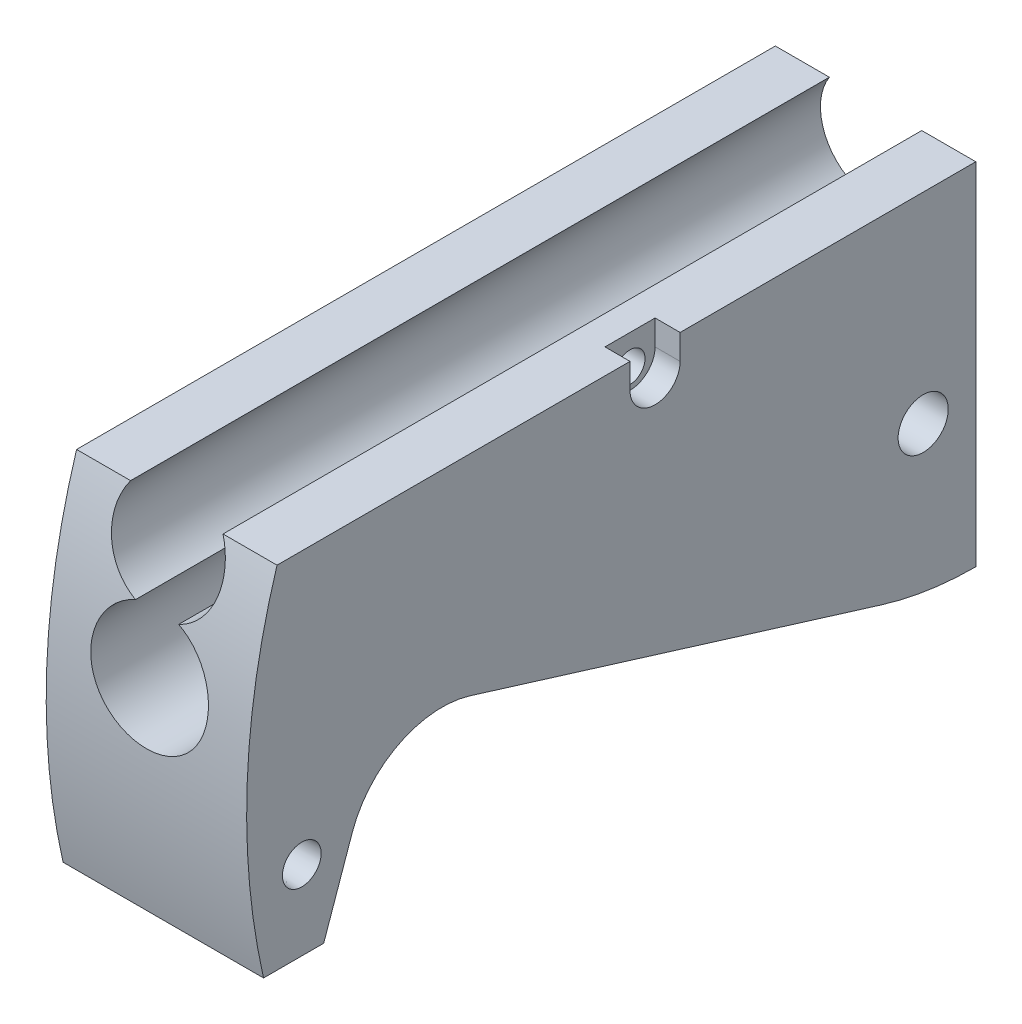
SolidWorks part; units mm, degrees
ref_plane "Front Plane" through (0, 0, 0) normal (0, 0, 1) x (1, 0, 0)
ref_plane "Top Plane" through (0, 0, 0) normal (0, 1, 0) x (1, 0, 0)
ref_plane "Right Plane" through (0, 0, 0) normal (1, 0, 0) x (0, 0, -1)
sketch "Sketch1" plane through (0, 0, 0) normal (0, 0, 1) x (1, 0, 0)
  line L1 (-20, 35) -> (20, 35)
  line L2 (-20, 35) -> (-20, -35)
  line L3 (-20, -35) -> (20, -35)
  line L4 (20, 35) -> (20, -35)
  line L5 (-20, 35) -> (20, -35) construction
  line L6 (-20, -35) -> (20, 35) construction
  point P0 (0, 0)
  dimension "D1" = 40
  dimension "D2" = 70
extrude "Boss-Extrude1" add sketch "Sketch1" along normal blind 147
sketch "Sketch2" plane through (20, 0, 0) normal (1, 0, 0) x (0, 0, -1)
  line L0 (-147, 29) -> (0, 29) construction
  line L1 (-147, -35) -> (0, -35) construction
  line L2 (-130.1245, -35) -> (-124.4353, -18.7289)
  line L3 (-100.898, -6.8446) -> (-18.8698, -32.155)
  line L4 (-147, -35) -> (-147, 35) construction
  line L5 (0, -35) -> (0, 35) construction
  line L6 (-147, 35) -> (0, 35) construction
  line L7 (0, -35) -> (0, 35) construction
  line L9 (-139.438, 35) -> (0, 35)
  line L10 (0, 35) -> (0, -35)
  line L11 (-130.1245, -35) -> (-142.1245, -35)
  arc A0 (-124.4353, -18.7289) -> (-100.898, -6.8446) centre (-106.5, -25) cw
  arc A1 (-18.8698, -32.155) -> (0, -35) centre (0, 29) ccw
  circle A2 centre (-10.5, -5) radius 5
  arc A3 (-139.438, 35) -> (-142.1245, -35) centre (-10.5, -5) ccw
  dimension "D2" = 19
  dimension "D4" = 128
  dimension "D8" = 10
  dimension "D10" = 270
  dimension "D3" = 6
  dimension "D5" = 60
  dimension "D6" = 40.5
  dimension "D7" = 10.5
  dimension "D9" = 40
  dimension "D11" = 12
extrude "Cut-Extrude1" cut sketch "Sketch2" against normal blind 147 flip side to cut
ref_plane "Plane1" through (0, 0, 147) normal (0, 0, 1) x (1, 0, 0)
sketch "Sketch3" plane through (0, 0, 147) normal (0, 0, 1) x (1, 0, 0)
  line L0 (-20, 35) -> (20, 35) construction
  line L1 (-9.2195, 35) -> (9.2195, 35)
  arc A0 (-9.2195, 35) -> (9.2195, 35) centre (0, 29) ccw
  circle A1 centre (0, 8) radius 6
  dimension "D1" = 22
  dimension "D2" = 12
  dimension "D3" = 6
  dimension "D4" = 27
extrude "Cut-Extrude2" cut sketch "Sketch3" against normal through all
ref_plane "Plane2" through (2, 0, 0) normal (1, 0, 0) x (0, 0, -1)
sketch "Sketch7" plane through (2, 0, 0) normal (1, 0, 0) x (0, 0, -1)
  line L1 (0, -35) -> (0, 35) construction
  line L3 (0, -35) -> (0, 25)
  line L5 (0, 25) -> (-63.8749, 25)
  arc A0 (-63.8749, 25) -> (0, -35) centre (0, 29) ccw
  dimension "D1" = 60
extrude "Cut-Extrude6" cut sketch "Sketch7" against normal blind 4
sketch "Sketch8" plane through (0, 0, 147) normal (0, 0, 1) x (1, 0, 0)
  circle A0 centre (0, 8) radius 11.69
  dimension "D1" = 23.38
extrude "Cut-Extrude7" cut sketch "Sketch8" against normal blind 33
sketch "Sketch10" plane through (0, 0, 0) normal (0, 0, -1) x (-1, 0, 0)
  circle A0 centre (0, 8) radius 6.5
  dimension "D1" = 13
extrude "Cut-Extrude8" cut sketch "Sketch10" against normal blind 64
sketch "Sketch11" plane through (20, 0, 0) normal (1, 0, 0) x (0, 0, -1)
  line L1 (-142.1245, -35) -> (-130.1245, -35) construction
  circle A0 centre (-134.5, -19.2) radius 3.865
  dimension "D1" = 7.73
  dimension "D2" = 28
  dimension "D3" = 15.8
extrude "Cut-Extrude10" cut sketch "Sketch11" against normal blind 15.2 draft 2.27
hole_wizard "Ø6.5 (6.5) Diameter Hole1" positions "Sketch13" profile "Sketch12" hole size "Ø6.5" standard "ANSI Metric"
sketch "Sketch13" plane through (4.8, 0, 0) normal (1, 0, 0) x (0, 0, -1)
  point P0 (-134.5, -19.2)
sketch "Sketch12" plane through (4.8, -19.2, 134.5) normal (0, 1, 0) x (0, 0, -1)
  line L0 (0, 0) -> (0, 13.3528)
  line L1 (0, 13.3528) -> (3.25, 11.4)
  line L2 (3.25, 11.4) -> (3.25, 0)
  line L5 (3.25, 0) -> (0, 0)
  line L10 (0, 13.3528) -> (-3.25, 11.4) construction
  line L11 (0, -6.35) -> (0, 107.95) construction
  dimension "Hole Dia." = 6.5
  dimension "Hole Depth" = 11.4
  dimension "Drill Angle" = 118
sketch "Sketch14" plane through (-20, 0, 0) normal (-1, 0, 0) x (0, 0, 1)
  circle A0 centre (64, -5) radius 4.05
  dimension "D1" = 8.1
  dimension "D2" = 42.5
extrude "Cut-Extrude11" cut sketch "Sketch14" against normal blind 15.2 draft 3.9
hole_wizard "Ø6.0 (6) Diameter Hole2" positions "Sketch20" profile "Sketch19" hole size "Ø6.0" standard "ANSI Metric"
sketch "Sketch20" plane through (-4.8, 0, 0) normal (-1, 0, 0) x (0, 0, 1)
  point P0 (64, -5)
sketch "Sketch19" plane through (-4.8, -5, 64) normal (0, 1, 0) x (0, 0, 1)
  line L0 (0, 0) -> (0, 12.3026)
  line L1 (0, 12.3026) -> (3, 10.5)
  line L2 (3, 10.5) -> (3, 0)
  line L5 (3, 0) -> (0, 0)
  line L10 (0, 12.3026) -> (-3, 10.5) construction
  line L11 (0, -6.35) -> (0, 107.95) construction
  dimension "Hole Dia." = 6
  dimension "Hole Depth" = 10.5
  dimension "Drill Angle" = 118
sketch "Sketch22" plane through (20, 0, 0) normal (1, 0, 0) x (0, 0, -1)
  line L0 (-139.438, 35) -> (0, 35) construction
  line L1 (-69, 30) -> (-69, 35)
  line L2 (-59, 30) -> (-59, 35)
  line L3 (-59, 35) -> (-69, 35)
  arc A0 (-69, 30) -> (-59, 30) centre (-64, 30) ccw
  dimension "D1" = 5
extrude "Cut-Extrude12" cut sketch "Sketch22" against normal blind 5
sketch "Sketch23" plane through (15, 0, 0) normal (1, 0, 0) x (0, 0, -1)
  line L0 (-59, 35) -> (0, 35) construction
  circle A0 centre (-64, 29) radius 3
  dimension "D1" = 6
  dimension "D2" = 6
extrude "Cut-Extrude13" cut sketch "Sketch23" against normal up to next
